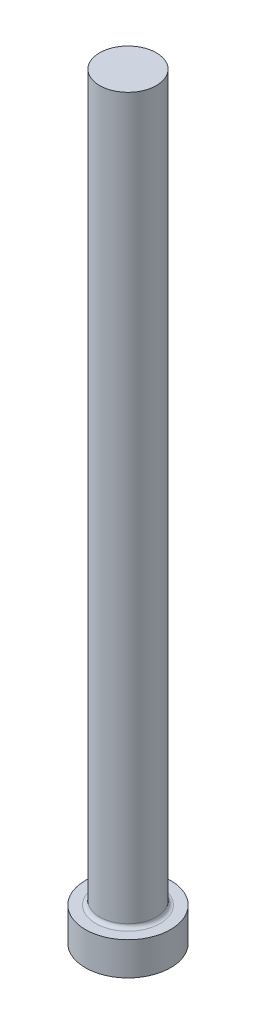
SolidWorks part; units mm, degrees
ref_plane "Plano frontal" through (0, 0, 0) normal (0, 0, 1) x (1, 0, 0)
ref_plane "Plano superior" through (0, 0, 0) normal (0, 1, 0) x (1, 0, 0)
ref_plane "Plano direito" through (0, 0, 0) normal (1, 0, 0) x (0, 0, -1)
sketch "Esboço1" plane through (0, 0, 0) normal (0, 0, 1) x (1, 0, 0)
  line L0 (0, 0) -> (9, 0)
  line L1 (9, 0) -> (9, 7)
  line L2 (9, 7) -> (6.8, 7)
  line L3 (6, 7.8) -> (6, 160)
  line L4 (6, 160) -> (0, 160)
  line L5 (0, 160) -> (0, 0) construction
  line L6 (0, 0) -> (0, 160)
  arc A0 (6.8, 7) -> (6, 7.8) centre (6.8, 7.8) cw
  dimension "D3" = 0.8
  dimension "D1" = 18
  dimension "D2" = 12
  dimension "D4" = 7
  dimension "D5" = 160
revolve "Revolução1" add sketch "Esboço1" angle 360 about L5
sketch "Esboço2"
  dimension "D1" = 1.0125
  dimension "D2" = 1.575
  dimension "D3" = 0.675
  dimension "D4" = 4.8375
wrap "Envolver1" sketch "Esboço2" wrap type deboss source sketch "Esboço2" thickness 0.1 parameters "D1"=0.1
